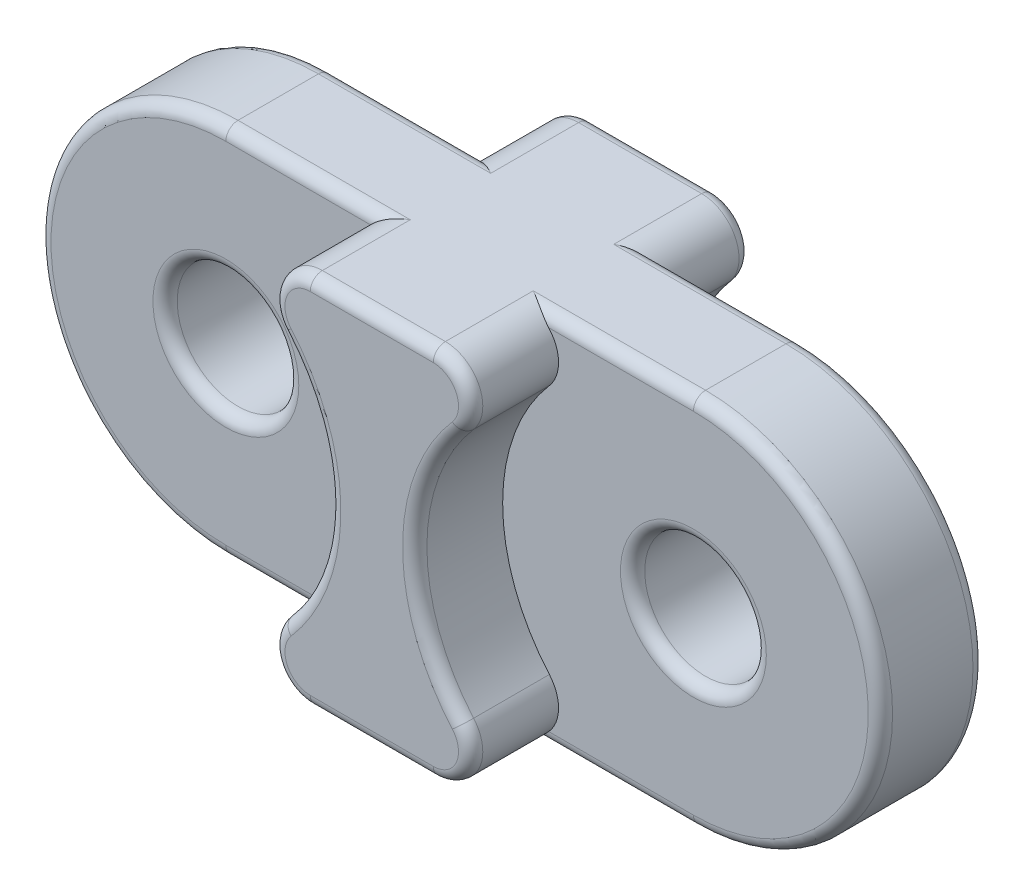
SolidWorks part; units mm, degrees
ref_plane "Front Plane" through (0, 0, 0) normal (0, 0, 1) x (1, 0, 0)
ref_plane "Top Plane" through (0, 0, 0) normal (0, 1, 0) x (1, 0, 0)
ref_plane "Right Plane" through (0, 0, 0) normal (1, 0, 0) x (0, 0, -1)
sketch "Sketch1" plane through (0, 0, 0) normal (0, 0, 1) x (1, 0, 0)
  line L0 (0, 0) -> (31.75, 0) construction
  line L1 (0, 12.7) -> (31.75, 12.7)
  line L2 (0, -12.7) -> (31.75, -12.7)
  arc A0 (0, 12.7) -> (0, -12.7) centre (0, 0) ccw
  arc A1 (31.75, -12.7) -> (31.75, 12.7) centre (31.75, 0) ccw
  point P3 (15.875, 0)
  dimension "D1" = 31.75
  dimension "D2" = 25.4
extrude "Boss-Extrude1" add sketch "Sketch1" along normal mid plane 19.05
sketch "Sketch2" plane through (0, 0, 9.525) normal (0, 0, 1) x (1, 0, 0)
  circle A0 centre (31.75, 0) radius 12.954
  circle A1 centre (0, 0) radius 12.954
  dimension "D1" = 25.908
extrude "Cut-Extrude1" cut sketch "Sketch2" against normal blind 5.969
mirror "Mirror1" about plane through (0, 0, 0) normal (0, 0, 1) of "Cut-Extrude1"
sketch "Sketch4" plane through (0, 0, 3.556) normal (0, 0, 1) x (1, 0, 0)
  circle A0 centre (0, 0) radius 4.1275
  circle A1 centre (31.75, 0) radius 4.1275
  dimension "D1" = 8.255
extrude "Cut-Extrude2" cut sketch "Sketch4" against normal through all
fillet "Fillet1" radius 2.54 8 edges at (29.1973, -12.7, 6.5405) (29.1973, -12.7, -6.5405) (2.5527, -12.7, -6.5405) (2.5527, -12.7, 6.5405) (29.1973, 12.7, -6.5405) (29.1973, 12.7, 6.5405) (2.5527, 12.7, 6.5405) (2.5527, 12.7, -6.5405)
fillet "Fillet3" radius 0.8255 32 edges at (9.3867, -11.2138, 9.525) (12.954, 0, 9.525) (9.3867, 11.2138, 9.525) (15.875, 12.7, 9.525) (22.3633, 11.2138, 9.525) (18.796, 0, 9.525) (22.3633, -11.2138, 9.525) (15.875, -12.7, 9.525) (22.3633, 11.2138, -9.525) (15.875, 12.7, -9.525) (9.3867, 11.2138, -9.525) (12.954, 0, -9.525) (9.3867, -11.2138, -9.525) (15.875, -12.7, -9.525) (22.3633, -11.2138, -9.525) (18.796, 0, -9.525) (44.45, 0, 3.556) (25.9011, -12.7, 3.556) (25.9011, 12.7, 3.556) (5.8489, 12.7, -3.556) (5.8489, -12.7, -3.556) (-12.7, 0, -3.556) (25.9011, -12.7, -3.556) (25.9011, 12.7, -3.556) (44.45, 0, -3.556) (5.8489, -12.7, 3.556) (-12.7, 0, 3.556) (5.8489, 12.7, 3.556) (27.6225, 0, -3.556) (4.1275, 0, 3.556) (-4.1275, 0, -3.556) (35.8775, 0, 3.556)
